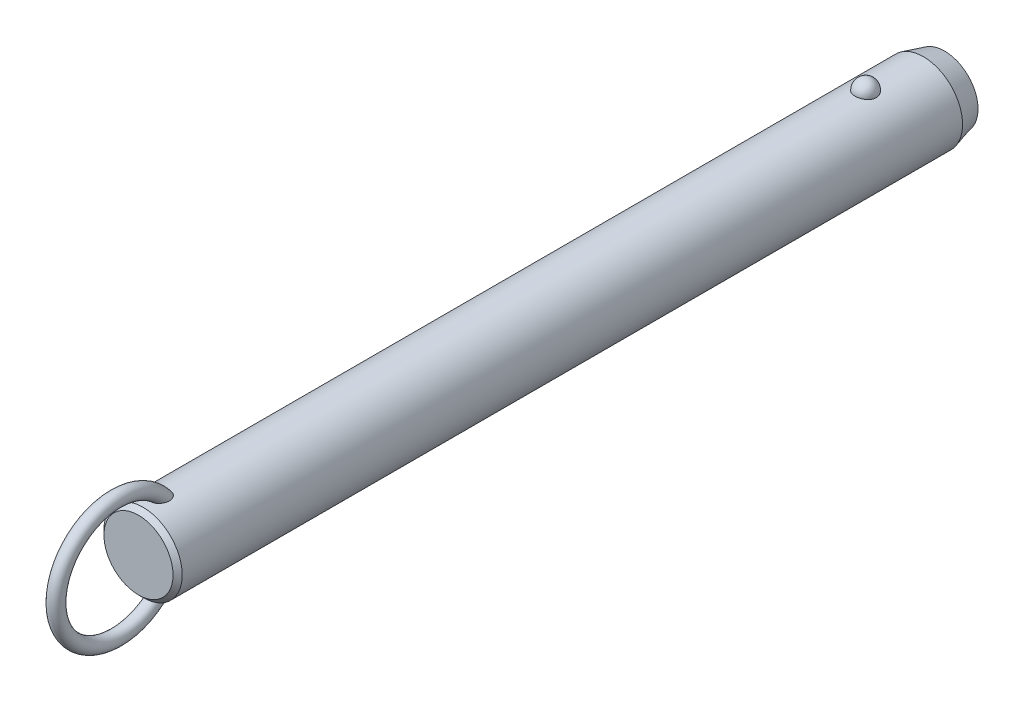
SolidWorks part; units mm, degrees
ref_plane "Front Plane" through (0, 0, 0) normal (0, 0, 1) x (1, 0, 0)
ref_plane "Top Plane" through (0, 0, 0) normal (0, 1, 0) x (1, 0, 0)
ref_plane "Right Plane" through (0, 0, 0) normal (1, 0, 0) x (0, 0, -1)
sketch "Sketch2" plane through (0, 0, 0) normal (0, 0, 1) x (1, 0, 0)
  circle A0 centre (0, 0) radius 11.1
  point P3 (0, 11.1)
  dimension "D1" = 22.2
extrude "Boss-Extrude1" add sketch "Sketch2" along normal blind 190.5
sketch "Sketch3" plane through (0, 0, 0) normal (0, 0, -1) x (-1, 0, 0)
  circle A0 centre (0, 0) radius 11.1
  dimension "D1" = 22.2
extrude "Boss-Extrude2" add sketch "Sketch3" along normal blind 25.4
chamfer "Chamfer1" distance 6 angle 15 1 edges at (-11.1, 0, -25.4)
sketch "Sketch12" plane through (0, 0, 0) normal (1, 0, 0) x (0, 0, -1)
  line L0 (-190.5, 11.1) -> (-190.5, -11.1) construction
  point P0 (-190.5, 0)
sketch "Sketch13" plane through (0, 0, 0) normal (1, 0, 0) x (0, 0, -1)
  circle A0 centre (-209.55, 0) radius 19.05
  point P2 (-190.5, 0)
  dimension "D1" = 38.1
sketch "Sketch14" plane through (0, 0, 0) normal (0, 1, 0) x (1, 0, 0)
  circle A0 centre (0, -192.5) radius 2
  point P2 (0, -190.5)
  dimension "D1" = 4
sweep "Sweep1" add profiles "Sketch14" path "Sketch13"
sketch "Sketch15" plane through (0, 0, 190.5) normal (0, 0, 1) x (1, 0, 0)
  circle A0 centre (0, 0) radius 11.1
  dimension "D1" = 22.2
extrude "Boss-Extrude3" add sketch "Sketch15" along normal blind 12.7
chamfer "Chamfer2" distance 1.3 angle 45 1 edges at (11.1, 0, 203.2)
sketch "Sketch18" plane through (0, 0, 0) normal (1, 0, 0) x (0, 0, -1)
  line L0 (19.4, 11.1) -> (-194.068, 11.1) construction
  line L1 (3, 14.1) -> (3, 8.1)
  line L2 (-194.068, -11.1) -> (19.4, -11.1) construction
  arc A0 (3, 14.1) -> (3, 8.1) centre (3, 11.1) ccw
  point P4 (0, 11.1)
  dimension "D1" = 25.2
revolve "Revolve1" add sketch "Sketch18" angle 360 about L1
